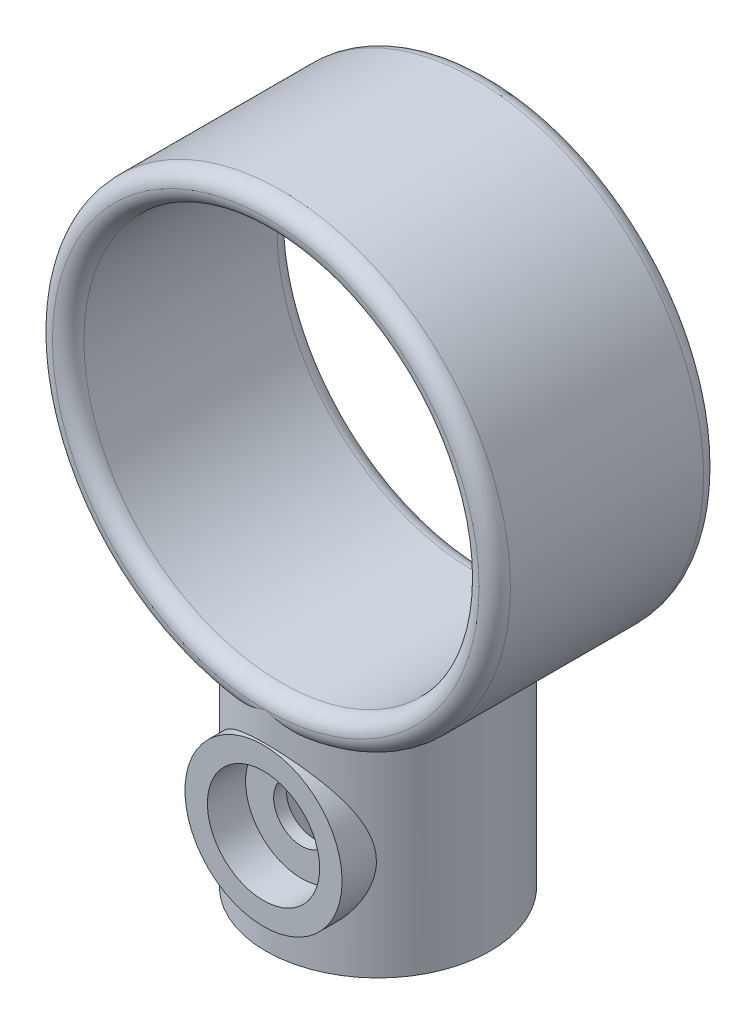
SolidWorks part; units mm, degrees
ref_plane "Front" through (0, 0, 0) normal (0, 0, 1) x (1, 0, 0)
ref_plane "Top" through (0, 0, 0) normal (0, 1, 0) x (1, 0, 0)
ref_plane "Right" through (0, 0, 0) normal (1, 0, 0) x (0, 0, -1)
sketch "Sketch1"
  dimension "D1" = 22.352
  dimension "D2" = 30.3833
extrude "Base-Extrude" add sketch "Sketch1" along normal mid plane 12.7
shell "Shell1" thickness 1.778
fillet "Fillet1" radius 0.889 4 edges at (12.954, 0, -6.35) (12.954, 0, 6.35) (11.176, 0, -6.35) (11.176, 0, 6.35)
ref_plane "Plane4" through (0, -23.876, 0) normal (0, 1, 0) x (-1, 0, 0)
sketch "Sketch2"
  dimension "D1" = 12.7
extrude "Boss-Extrude1" add sketch "Sketch2" along normal up to next
sketch "Sketch3"
  dimension "D1" = 7.874
  dimension "D2" = 3.175
extrude "Cut-Extrude1" cut sketch "Sketch3" against normal blind 10.795
ref_plane "Plane5" through (0, -17.3714, 6.35) normal (0, 0, 1) x (-1, 0, 0)
ref_plane "Plane6" through (0, 0, 6.477) normal (0, 0, 1) x (1, 0, 0)
sketch "Sketch4"
  dimension "D1" = 8.89
  dimension "D2" = 1.27
extrude "Boss-Extrude2" add sketch "Sketch4" against normal up to surface (1.9422 mm away)
sketch "Sketch5"
  dimension "D1" = 6.35
extrude "Cut-Extrude2" cut sketch "Sketch5" against normal blind 2.159
sketch "Sketch6"
  dimension "D1" = 3.175
extrude "Cut-Extrude3" cut sketch "Sketch6" against normal up to next
